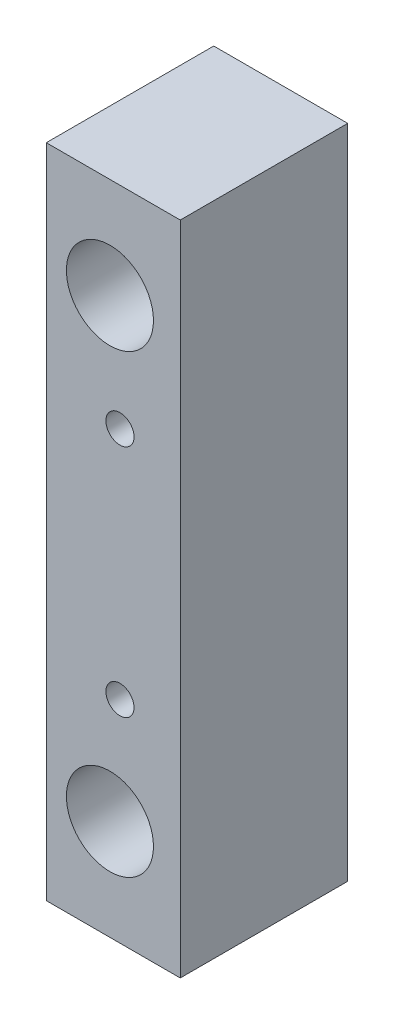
SolidWorks part; units mm, degrees
ref_plane "Face" through (0, 0, 0) normal (0, 0, 1) x (1, 0, 0)
ref_plane "Dessus" through (0, 0, 0) normal (0, 1, 0) x (1, 0, 0)
ref_plane "Droite" through (0, 0, 0) normal (1, 0, 0) x (0, 0, -1)
sketch "Esquisse1" plane through (0, 0, 0) normal (0, 0, 1) x (1, 0, 0)
  line L1 (0, 0) -> (40, 0)
  line L2 (0, 0) -> (0, 196)
  line L3 (0, 196) -> (40, 196)
  line L4 (40, 0) -> (40, 196)
  dimension "D1" = 196
  dimension "D2" = 40
extrude "Extrusion1" add sketch "Esquisse1" along normal blind 50
hole_wizard "Dégagement M81" positions "Esquisse5" profile "Esquisse4" hole size "M8" standard "ISO"
sketch "Esquisse5" plane through (0, 0, 50) normal (0, 0, 1) x (1, 0, 0)
  line L0 (0, 98) -> (40, 98) construction
  line L1 (40, 0) -> (40, 196) construction
  line L2 (0, 196) -> (0, 0) construction
  point P0 (22, 133)
  point P7 (22, 63)
  dimension "D1" = 35
  dimension "D2" = 22
sketch "Esquisse4" plane through (22, 133, 50) normal (1, 0, 0) x (0, -1, 0)
  line L0 (0, 0) -> (0, 50)
  line L1 (0, 50) -> (4.2, 50)
  line L2 (4.2, 50) -> (4.2, 0)
  line L5 (4.2, 0) -> (0, 0)
  line L11 (0, -6.35) -> (0, 107.95) construction
  dimension "Diamètre du perçage jusqu'au prochain" = 8.4
  dimension "Profondeur du perçage jusqu'au prochain" = 50
sketch "Esquisse6" plane through (0, 0, 50) normal (0, 0, 1) x (1, 0, 0)
  line L0 (0, 98) -> (40, 98) construction
  line L1 (0, 196) -> (0, 0) construction
  line L2 (40, 0) -> (40, 196) construction
  circle A0 centre (19, 166) radius 13
  circle A1 centre (19, 30) radius 13
  dimension "D1" = 26
  dimension "D2" = 26
  dimension "D3" = 19
  dimension "D4" = 19
  dimension "D5" = 68
  dimension "D6" = 68
extrude "Enlèv. mat.-Extru.1" cut sketch "Esquisse6" against normal through all
